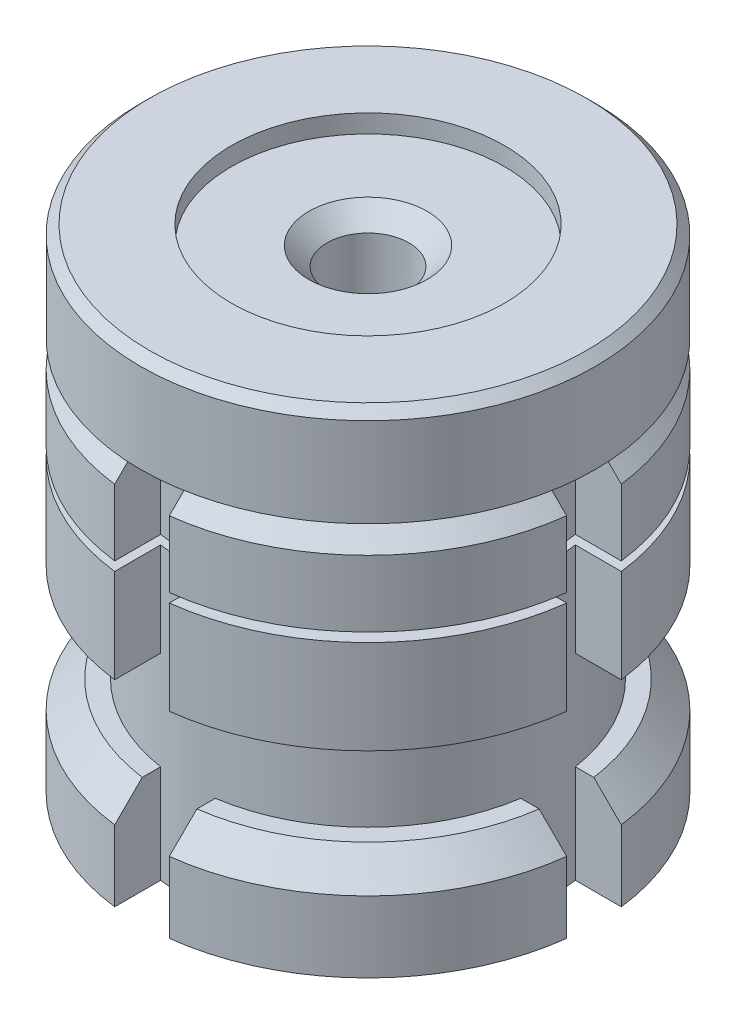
SolidWorks part; units mm, degrees
ref_plane "Front Plane" through (0, 0, 0) normal (0, 0, 1) x (1, 0, 0)
ref_plane "Top Plane" through (0, 0, 0) normal (0, 1, 0) x (1, 0, 0)
ref_plane "Right Plane" through (0, 0, 0) normal (1, 0, 0) x (0, 0, -1)
sketch "Sketch1" plane through (0, 0, 0) normal (0, 1, 0) x (1, 0, 0)
  circle A0 centre (0, 0) radius 12.5
  dimension "D1" = 25
extrude "Boss-Extrude1" add sketch "Sketch1" along normal blind 10.8
sketch "Sketch2" plane through (0, 0, 0) normal (1, 0, 0) x (0, 0, -1)
  line L0 (0, 13.2648) -> (0, -2.3994) construction
  line L1 (-12.5, 0) -> (12.5, 0) construction
  line L2 (-12.5, 5.65) -> (-7.5, 5.65)
  line L3 (-12.5, 5.65) -> (-12.5, 5.15)
  line L4 (-12.5, 5.15) -> (-7.5, 5.15)
  line L5 (-7.5, 5.65) -> (-7.5, 5.15)
  line L6 (-12.5, 5.65) -> (-7.5, 5.15) construction
  line L7 (-12.5, 5.15) -> (-7.5, 5.65) construction
  point P3 (-10, 5.4)
  point P8 (-12.5, 5.4)
  dimension "D1" = 0.5
  dimension "D2" = 12.5
  dimension "D3" = 7.5
  dimension "D4" = 5.4
revolve "Cut-Revolve1" cut sketch "Sketch2" angle 360 about L0
sketch "Sketch3" plane through (0, 0, 0) normal (0, -1, 0) x (1, 0, 0)
  circle A0 centre (0, 0) radius 10
  dimension "D1" = 20
extrude "Boss-Extrude2" add sketch "Sketch3" along normal blind 10.8
sketch "Sketch4" plane through (0, -10.8, 0) normal (0, -1, 0) x (1, 0, 0)
  circle A0 centre (0, 0) radius 12.5
  circle A1 centre (0, 0) radius 12.5 construction
extrude "Boss-Extrude3" add sketch "Sketch4" against normal blind 5.4
sketch "Sketch5" plane through (0, 10.8, 0) normal (0, 1, 0) x (1, 0, 0)
  line L0 (-12.4097, 1.5) -> (-9.8869, 1.5)
  line L2 (-9.8869, -1.5) -> (-12.4097, -1.5)
  line L3 (-1.5, 12.4097) -> (-1.5, 9.8869)
  line L5 (1.5, 9.8869) -> (1.5, 12.4097)
  line L6 (9.8869, 1.5) -> (12.4097, 1.5)
  line L8 (12.4097, -1.5) -> (9.8869, -1.5)
  line L9 (-1.5, -9.8869) -> (-1.5, -12.4097)
  line L11 (1.5, -12.4097) -> (1.5, -9.8869)
  arc A0 (-9.8869, 1.5) -> (-9.8869, -1.5) centre (0, 0) ccw
  circle A1 centre (0, 0) radius 10 construction
  arc A2 (-12.4097, 1.5) -> (-12.4097, -1.5) centre (0, 0) ccw
  circle A3 centre (0, 0) radius 12.5 construction
  arc A4 (-1.5, -9.8869) -> (1.5, -9.8869) centre (0, 0) ccw
  arc A5 (-1.5, -12.4097) -> (1.5, -12.4097) centre (0, 0) ccw
  arc A6 (9.8869, -1.5) -> (9.8869, 1.5) centre (0, 0) ccw
  arc A7 (12.4097, -1.5) -> (12.4097, 1.5) centre (0, 0) ccw
  arc A8 (1.5, 9.8869) -> (-1.5, 9.8869) centre (0, 0) ccw
  arc A9 (1.5, 12.4097) -> (-1.5, 12.4097) centre (0, 0) ccw
  point P1 (-12.5, 0)
  point P5 (-10, 0)
  point P25 (0, 0)
  dimension "D1" = 3
extrude "Cut-Extrude4" cut sketch "Sketch5" against normal up to surface (21.6 mm away)
chamfer "Chamfer1" distance 1.5 angle 45 8 edges at (-8.8388, -5.4, -8.8388) (8.8388, -5.4, -8.8388) (-8.8388, 10.8, -8.8388) (8.8388, 10.8, -8.8388) (8.8388, 10.8, 8.8388) (8.8388, -5.4, 8.8388) (-8.8388, -5.4, 8.8388) (-8.8388, 10.8, 8.8388)
sketch "Sketch6" plane through (0, 10.8, 0) normal (0, 1, 0) x (1, 0, 0)
  circle A0 centre (0, 0) radius 12.5
  arc A1 (1.5, -12.4097) -> (12.4097, -1.5) centre (0, 0) ccw construction
extrude "Boss-Extrude4" add sketch "Sketch6" along normal blind 5.4
chamfer "Chamfer2" distance 0.5 angle 45 1 edges at (0, 16.2, 12.5)
sketch "Sketch7" plane through (0, 16.2, 0) normal (0, 1, 0) x (1, 0, 0)
  circle A0 centre (0, 0) radius 7.5
  dimension "D1" = 15
extrude "Cut-Extrude5" cut sketch "Sketch7" against normal blind 1
sketch "Sketch8" plane through (0, 15.2, 0) normal (0, 1, 0) x (1, 0, 0)
  circle A0 centre (0, 0) radius 2.25
  dimension "D1" = 4.5
extrude "Cut-Extrude6" cut sketch "Sketch8" against normal up to surface (26 mm away)
chamfer "Chamfer3" distance 1 angle 45 2 edges at (0, -10.8, -2.25) (0, 15.2, 2.25)
